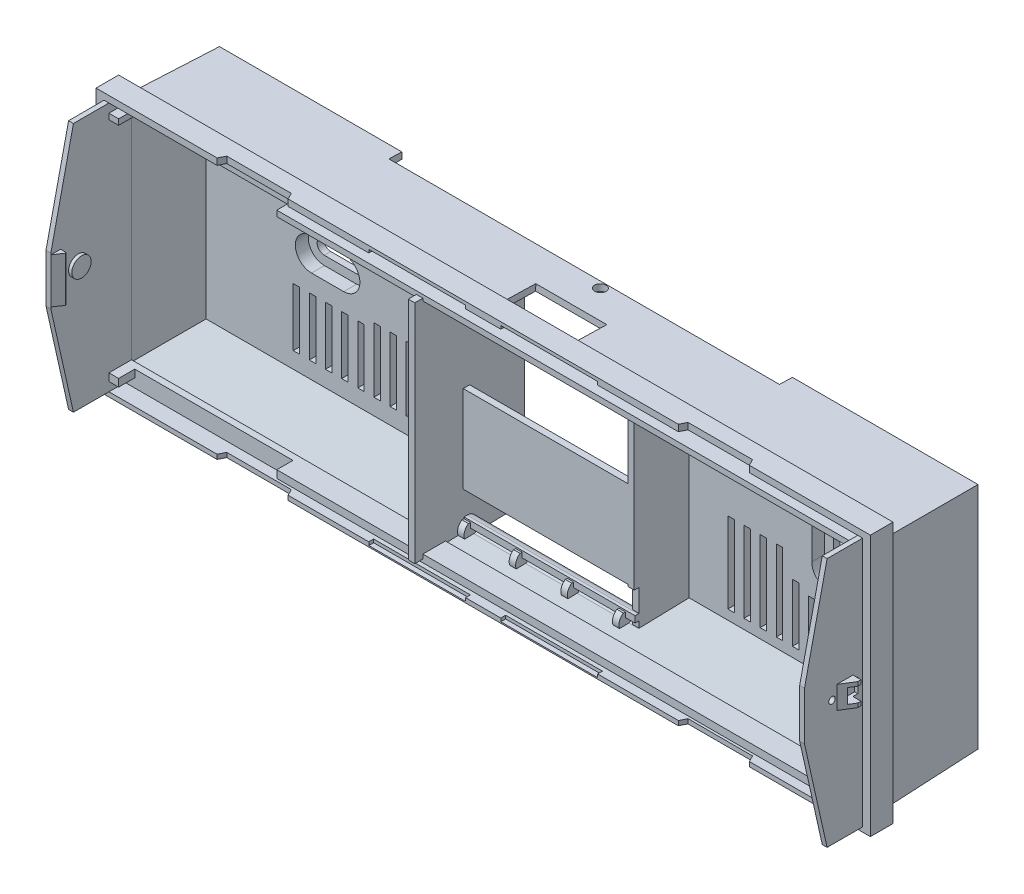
SolidWorks part; units mm, degrees
ref_plane "Plan1" through (0, 0, 0) normal (0, 0, 1) x (1, 0, 0)
ref_plane "Plan2" through (0, 0, 0) normal (0, 1, 0) x (1, 0, 0)
ref_plane "Plan3" through (0, 0, 0) normal (1, 0, 0) x (0, 0, -1)
sketch "Esquisse1" plane through (0, 0, 0) normal (0, 0, 1) x (1, 0, 0)
  line L1 (-124, 35.5) -> (111, 35.5)
  line L2 (-124, 35.5) -> (-124, -35.5)
  line L3 (-124, -35.5) -> (111, -35.5)
  line L4 (111, 35.5) -> (111, -35.5)
  dimension "D1" = 235
  dimension "D2" = 71
  dimension "D3" = 35.5
  dimension "D4" = 111
extrude "Extrusion1" add sketch "Esquisse1" along normal blind 1.5
sketch "Esquisse2" plane through (0, 0, 0) normal (0, 0, -1) x (-1, 0, 0)
  line L1 (-111, 35.5) -> (124, 35.5)
  line L2 (-111, 35.5) -> (-111, -35.5)
  line L3 (-111, -35.5) -> (124, -35.5)
  line L4 (124, 35.5) -> (124, -35.5)
extrude "Extrusion2" add sketch "Esquisse2" against normal blind 28.5 draft 1.5 from offset 4 contours L2 L3 L4 L1
sketch "Esquisse3" plane through (0, 0, 24.5) normal (0, 0, 1) x (1, 0, 0)
  line L0 (111.7463, 36.2463) -> (-124.7463, 36.2463) construction
  line L1 (-122.7463, 34.2463) -> (109.7463, 34.2463)
  line L2 (-122.7463, 34.2463) -> (-122.7463, -34.2463)
  line L3 (-122.7463, -34.2463) -> (109.7463, -34.2463)
  line L4 (109.7463, 34.2463) -> (109.7463, -34.2463)
  line L5 (-124.7463, 36.2463) -> (-124.7463, -36.2463) construction
  line L6 (111.7463, -36.2463) -> (-124.7463, -36.2463) construction
  line L7 (111.7463, 36.2463) -> (111.7463, -36.2463) construction
  dimension "D1" = 2
  dimension "D2" = 2
  dimension "D3" = 2
  dimension "D4" = 2
extrude "Enlèv. mat.-Extru.1" cut sketch "Esquisse3" against normal blind 22.5 draft 1.5
sketch "Esquisse4" plane through (0, 0, -4) normal (0, 0, -1) x (-1, 0, 0)
  line L0 (-111, 35.5) -> (124, 35.5) construction
  line L1 (-109, 33.5) -> (122, 33.5)
  line L2 (-109, 33.5) -> (-109, -33.5)
  line L3 (-109, -33.5) -> (122, -33.5)
  line L4 (122, 33.5) -> (122, -33.5)
  line L5 (-111, 35.5) -> (-111, -35.5) construction
  line L6 (-111, -35.5) -> (124, -35.5) construction
  line L7 (124, 35.5) -> (124, -35.5) construction
  dimension "D1" = 2
  dimension "D2" = 2
  dimension "D3" = 2
  dimension "D4" = 2
extrude "Enlèv. mat.-Extru.2" cut sketch "Esquisse4" against normal blind 4
sketch "Esquisse5" plane through (0, 0, 0) normal (0, 1, 0) x (1, 0, 0)
  line L1 (111, 4) -> (-124, 4) construction
  line L2 (-67.5, 4) -> (53.5, 4)
  line L3 (-67.5, 4) -> (-67.5, 0)
  line L4 (-67.5, 0) -> (53.5, 0)
  line L5 (53.5, 4) -> (53.5, 0)
  dimension "D1" = 4
  dimension "D2" = 121
  dimension "D3" = 67.5
extrude "Enlèv. mat.-Extru.3" cut sketch "Esquisse5" against normal mid plane 80
sketch "Esquisse6" plane through (0, 0, 0) normal (0, 0, -1) x (-1, 0, 0)
  line L0 (-111.7463, -36.2463) -> (124.7463, -36.2463) construction
  line L1 (-25.5, 33.6047) -> (25.5, 33.6047)
  line L2 (-25.5, 33.6047) -> (-25.5, -36.2463)
  line L3 (-25.5, -36.2463) -> (25.5, -36.2463)
  line L4 (25.5, 33.6047) -> (25.5, -36.2463)
  line L5 (-53.5, 35.6047) -> (67.5, 35.6047) construction
  dimension "D1" = 51
  dimension "D2" = 25.5
  dimension "D3" = 2
extrude "Enlèv. mat.-Extru.4" cut sketch "Esquisse6" against normal blind 17
sketch "Esquisse7" plane through (0, 35.5803, -0.9317) normal (0, 0.9997, -0.0262) x (-1, 0, 0)
  line L0 (-53.5, 0.932) -> (67.5, 0.932) construction
  line L2 (-11, 11.932) -> (11, 11.932)
  line L3 (-11, 11.932) -> (-11, 22.432)
  line L4 (-11, 22.432) -> (11, 22.432)
  line L5 (11, 11.932) -> (11, 22.432)
  circle A0 centre (0, 2.932) radius 1.75
  dimension "D1" = 3.5
  dimension "D2" = 2
  dimension "D3" = 10.5
  dimension "D4" = 22
  dimension "D5" = 11
  dimension "D6" = 11
extrude "Enlèv. mat.-Extru.5" cut sketch "Esquisse7" against normal blind 10
sketch "Esquisse8" plane through (0, 0, 0) normal (0, 0, -1) x (-1, 0, 0)
  line L0 (-25.5, 33.6047) -> (-25.5, -35.6047) construction
  line L1 (-111, 35.5) -> (-53.5, 35.5) construction
  line L2 (-78.5, 5) -> (-78.5, -5)
  line L3 (67.5, 35.5) -> (124, 35.5) construction
  line L4 (-62.5, 5) -> (-62.5, -5)
  line L5 (79.5, 8) -> (89.5, 8)
  line L6 (25.5, -35.6047) -> (25.5, 33.6047) construction
  line L7 (79.5, -8) -> (89.5, -8)
  arc A0 (-78.5, 5) -> (-62.5, 5) centre (-70.5, 5) cw
  arc A1 (-62.5, -5) -> (-78.5, -5) centre (-70.5, -5) cw
  arc A2 (79.5, 8) -> (79.5, -8) centre (79.5, 0) ccw
  arc A3 (89.5, 8) -> (89.5, -8) centre (89.5, 0) cw
  dimension "D7" = 8
  dimension "D8" = 8
  dimension "D1" = 16
  dimension "D2" = 10
  dimension "D3" = 10
  dimension "D4" = 10
  dimension "D5" = 53
  dimension "D6" = 30.5
  dimension "D9" = 10
  dimension "D10" = 10
  dimension "D11" = 10
  dimension "D12" = 16
  dimension "D13" = 35.5
  dimension "D14" = 64
extrude "Extrusion3" add sketch "Esquisse8" along normal blind 4
sketch "Esquisse9" plane through (81.6987, 0.3521, -4) normal (0, 0, -1) x (-1, 0, 0)
  line L2 (161.1987, 4.6479) -> (171.1987, 4.6479)
  line L4 (161.1987, -5.3521) -> (171.1987, -5.3521)
  line L8 (6.1987, 4.6479) -> (6.1987, -5.3521)
  line L9 (16.1987, 4.6479) -> (16.1987, -5.3521)
  arc A0 (19.1987, 4.6479) -> (3.1987, 4.6479) centre (11.1987, 4.6479) ccw construction
  arc A1 (3.1987, -5.3521) -> (19.1987, -5.3521) centre (11.1987, -5.3521) ccw construction
  arc A2 (171.1987, -8.3521) -> (171.1987, 7.6479) centre (171.1987, -0.3521) ccw construction
  arc A3 (161.1987, 7.6479) -> (161.1987, -8.3521) centre (161.1987, -0.3521) ccw construction
  arc A6 (16.1987, -5.3521) -> (6.1987, -5.3521) centre (11.1987, -5.3521) cw
  arc A7 (6.1987, 4.6479) -> (16.1987, 4.6479) centre (11.1987, 4.6479) cw
  arc A8 (171.1987, 4.6479) -> (171.1987, -5.3521) centre (171.1987, -0.3521) cw
  arc A9 (161.1987, 4.6479) -> (161.1987, -5.3521) centre (161.1987, -0.3521) ccw
  dimension "D7" = 10
  dimension "D8" = 5
  dimension "D2" = 5
  dimension "D5" = 5
  dimension "D1" = 5
  dimension "D3" = 10
  dimension "D4" = 10
  dimension "D6" = 10
  dimension "D9" = 10
  dimension "D10" = 10
extrude "Enlèv. mat.-Extru.6" cut sketch "Esquisse9" against normal blind 10 from offset 2
sketch "Esquisse10" plane through (0, 0, -4) normal (0, 0, -1) x (-1, 0, 0)
  line L2 (-72.75, 5) -> (-72.75, -5)
  line L3 (79.5, 2.25) -> (89.5, 2.25)
  line L4 (-68.25, 5) -> (-68.25, -5)
  line L6 (79.5, -2.25) -> (89.5, -2.25)
  arc A0 (-72.75, 5) -> (-68.25, 5) centre (-70.5, 5) cw
  arc A1 (-68.25, -5) -> (-72.75, -5) centre (-70.5, -5) cw
  arc A2 (-62.5, 5) -> (-78.5, 5) centre (-70.5, 5) ccw construction
  arc A3 (-78.5, -5) -> (-62.5, -5) centre (-70.5, -5) ccw construction
  arc A4 (79.5, 2.25) -> (79.5, -2.25) centre (79.5, 0) ccw
  arc A5 (89.5, 2.25) -> (89.5, -2.25) centre (89.5, 0) cw
  arc A6 (89.5, -8) -> (89.5, 8) centre (89.5, 0) ccw construction
  arc A7 (79.5, 8) -> (79.5, -8) centre (79.5, 0) ccw construction
  dimension "D2" = 2.25
  dimension "D3" = 4.5
  dimension "D5" = 10
  dimension "D1" = 4.5
  dimension "D4" = 10
  dimension "D6" = 10
extrude "Enlèv. mat.-Extru.7" cut sketch "Esquisse10" against normal blind 10
sketch "Esquisse11" plane through (0, 0, 2) normal (0, 0, 1) x (1, 0, 0)
  line L1 (25.5, 35) -> (27.5, 35)
  line L2 (25.5, 35) -> (25.5, -35)
  line L3 (25.5, -35) -> (27.5, -35)
  line L4 (27.5, 35) -> (27.5, -35)
  dimension "D1" = 2
  dimension "D2" = 70
  dimension "D3" = 35
  dimension "D4" = 25.5
extrude "Extrusion4" add sketch "Esquisse11" along normal blind 17
sketch "Esquisse12" plane through (0, 0, 2) normal (0, 0, 1) x (1, 0, 0)
  line L1 (-25.5, 35) -> (-27.5, 35)
  line L2 (-25.5, 35) -> (-25.5, -35)
  line L3 (-25.5, -35) -> (-27.5, -35)
  line L4 (-27.5, 35) -> (-27.5, -35)
  dimension "D1" = 2
  dimension "D2" = 70
  dimension "D3" = 35
  dimension "D4" = 25.5
extrude "Extrusion5" add sketch "Esquisse12" along normal blind 32
sketch "Esquisse13" plane through (25.5, 0, 0) normal (-1, 0, 0) x (0, 0, 1)
  line L1 (19, 4.5) -> (17, 4.5)
  line L2 (19, 4.5) -> (19, -22.5)
  line L3 (19, -22.5) -> (17, -22.5)
  line L4 (17, 4.5) -> (17, -22.5)
  line L6 (0, 0) -> (23.4559, 0) construction
  line L7 (19, 34.1023) -> (19, -34.1023) construction
  dimension "D1" = 2
  dimension "D2" = 27
  dimension "D3" = 4.5
extrude "Extrusion6" add sketch "Esquisse13" along normal up to next
sketch "Esquisse15" plane through (27.5, 0, 0) normal (1, 0, 0) x (0, 0, -1)
  line L0 (-19, -34.1023) -> (-19, 34.1023) construction
  line L1 (-17.5, -34.063) -> (-19, -34.1023)
  line L2 (-19, -34.1023) -> (-19, -23.1023)
  line L3 (-19, -23.1023) -> (-17.5, -23.1023)
  line L4 (-17.5, -34.063) -> (-17.5, -23.1023)
  line L7 (-19, -34.1023) -> (-2, -33.6571) construction
  point P11 (-13.9712, -36.3603)
  dimension "D1" = 11
  dimension "D2" = 1.5
extrude "Enlèv. mat.-Extru.8" cut sketch "Esquisse15" against normal blind 10
sketch "Esquisse14" plane through (-25.5, 0, 0) normal (1, 0, 0) x (0, 0, -1)
  line L0 (-24.5, -36.2463) -> (4, -35.5) construction
  line L1 (0, -35.6047) -> (0, 33.6047) construction
  line L2 (-17.75, -34.0695) -> (-17.75, -36.0695)
  line L3 (-17.75, -32.0695) -> (-18.75, -32.0695)
  line L4 (-18.75, -32.0695) -> (-18.75, -30.0695)
  line L5 (-18.75, -30.0695) -> (-17.75, -30.0695)
  arc A0 (-17.75, -36.0695) -> (-17.75, -30.0695) centre (-17.75, -33.0695) ccw
  arc A1 (-17.75, -34.0695) -> (-17.75, -32.0695) centre (-17.75, -33.0695) ccw
  dimension "D1" = 3
  dimension "D2" = 17.75
  dimension "D4" = 1
  dimension "D3" = 2
extrude "Extrusion7" add sketch "Esquisse14" along normal up to surface (53 mm away)
sketch "Esquisse16" plane through (-25.5, 0, 0) normal (1, 0, 0) x (0, 0, -1)
  line L0 (-20.3644, -34.5409) -> (-16.3644, -34.5409)
  line L1 (-16.3644, -34.5409) -> (-16.3644, -30.5409)
  line L2 (-16.3644, -30.5409) -> (-19.3644, -30.5409)
  arc A0 (-17.6977, -34.0682) -> (-17.75, -32.0695) centre (-17.75, -33.0695) ccw construction
  arc A2 (-19.3644, -30.5409) -> (-20.3644, -34.5409) centre (-17.75, -33.0695) ccw
  point P1 (-18.6119, -29.1773)
  point P7 (-19.9491, -35.2924)
  dimension "D1" = 3
  dimension "D2" = 4
  dimension "D3" = 4
  dimension "D4" = 1
extrude "Extrusion8" add sketch "Esquisse16" along normal blind 2
pattern_linear "Répétition linéaire1" count 4 spacing 16 along (1, 0, 0) of "Extrusion8"
sketch "Esquisse17" plane through (0, 0, 24.5) normal (0, 0, 1) x (1, 0, 0)
  line L1 (-122.7463, 34.2463) -> (109.1571, 34.2463)
  line L2 (-122.7463, 34.2463) -> (-122.7463, -33.6571)
  line L3 (-122.7463, -33.6571) -> (109.1571, -33.6571)
  line L4 (109.1571, 34.2463) -> (109.1571, -33.6571)
  line L5 (-126.7463, 40.7463) -> (113.1571, 40.7463)
  line L6 (-126.7463, 40.7463) -> (-126.7463, -40.1571)
  line L7 (-126.7463, -40.1571) -> (113.1571, -40.1571)
  line L8 (113.1571, 40.7463) -> (113.1571, -40.1571)
  dimension "D1" = 6.5
  dimension "D2" = 6.5
  dimension "D3" = 4
  dimension "D4" = 4
extrude "Extrusion9" add sketch "Esquisse17" along normal blind 7
sketch "Esquisse18" plane through (0, 0, 31.5) normal (0, 0, 1) x (1, 0, 0)
  line L0 (-122.7463, 34.2463) -> (-122.7463, -33.6571) construction
  line L1 (-122.7463, 35.9963) -> (109.1571, 35.9963)
  line L2 (-122.7463, 35.9963) -> (-122.7463, 38.7463)
  line L3 (-122.7463, 38.7463) -> (109.1571, 38.7463)
  line L4 (109.1571, 35.9963) -> (109.1571, 38.7463)
  line L5 (109.1571, -33.6571) -> (109.1571, 34.2463) construction
  line L6 (113.1571, 40.7463) -> (-126.7463, 40.7463) construction
  line L7 (0, 0) -> (-126.1043, 0) construction
  line L8 (109.1571, -35.9963) -> (109.1571, -38.7463)
  line L9 (-122.7463, -38.7463) -> (109.1571, -38.7463)
  line L10 (-122.7463, -35.9963) -> (-122.7463, -38.7463)
  line L11 (-122.7463, -35.9963) -> (109.1571, -35.9963)
  dimension "D1" = 2.75
  dimension "D2" = 2
extrude "Enlèv. mat.-Extru.9" cut sketch "Esquisse18" against normal blind 5
sketch "Esquisse19" plane through (0, -40.1571, 0) normal (0, -1, 0) x (1, 0, 0)
  line L0 (-126.7463, 31.5) -> (113.1571, 31.5) construction
  line L1 (-67.2463, 31.5) -> (-89.2463, 31.5)
  line L2 (-68.2463, 29.5) -> (-67.2463, 31.5)
  line L3 (-68.2463, 29.5) -> (-88.2463, 29.5)
  line L4 (-88.2463, 29.5) -> (-89.2463, 31.5)
  line L5 (113.1571, 31.5) -> (113.1571, 24.5) construction
  line L6 (74.6571, 29.5) -> (75.6571, 31.5)
  line L7 (54.6571, 29.5) -> (74.6571, 29.5)
  line L8 (54.6571, 29.5) -> (53.6571, 31.5)
  line L9 (53.6571, 31.5) -> (75.6571, 31.5)
  line L10 (-126.7463, 31.5) -> (-126.7463, 24.5) construction
  point P6 (113.1571, 28)
  point P13 (-126.7463, 28)
  dimension "D1" = 2
  dimension "D2" = 20
  dimension "D3" = 22
  dimension "D4" = 1
  dimension "D5" = 38.5
  dimension "D6" = 22
  dimension "D7" = 20
  dimension "D9" = 1
  dimension "D10" = 2
  dimension "D11" = 38.5
extrude "Enlèv. mat.-Extru.10" cut sketch "Esquisse19" against normal blind 2.5 and the other way blind 1
sketch "Esquisse20" plane through (0, 0, 31.5) normal (0, 0, 1) x (1, 0, 0)
  line L0 (-67.2463, -38.7463) -> (53.6571, -38.7463) construction
  line L1 (-42.2463, -38.7463) -> (-12.2463, -38.7463)
  line L2 (-42.2463, -38.7463) -> (-42.2463, -39.7463)
  line L3 (-42.2463, -39.7463) -> (-12.2463, -39.7463)
  line L4 (-12.2463, -38.7463) -> (-12.2463, -39.7463)
  line L5 (-67.2463, -38.7463) -> (-67.2463, -40.1571) construction
  line L6 (28.6571, -38.7463) -> (-1.3429, -38.7463)
  line L7 (28.6571, -38.7463) -> (28.6571, -39.7463)
  line L8 (28.6571, -39.7463) -> (-1.3429, -39.7463)
  line L9 (-1.3429, -38.7463) -> (-1.3429, -39.7463)
  point P10 (-67.2463, -39.4517)
  dimension "D1" = 1
  dimension "D2" = 30
  dimension "D3" = 25
  dimension "D4" = 1
  dimension "D5" = 30
  dimension "D6" = 25
extrude "Enlèv. mat.-Extru.11" cut sketch "Esquisse20" against normal blind 1.5
mirror "Symétrie1" about plane through (0, 0, 0) normal (0, 1, 0) of "Enlèv. mat.-Extru.10", "Enlèv. mat.-Extru.11"
sketch "Esquisse22" plane through (-122.7463, 0, 0) normal (1, 0, 0) x (0, 0, -1)
  line L0 (-31.5, -38.7463) -> (-42.5, -38.7463)
  line L1 (-42.5, -38.7463) -> (-49.5, -7.5013)
  line L2 (-49.5, -7.5013) -> (-49.5, 7.4987)
  line L3 (-49.5, 7.4987) -> (-42.5, 38.7463)
  line L4 (-42.5, 38.7463) -> (-31.5, 38.7463)
  line L6 (-31.5, 38.7463) -> (-31.5, -38.7463)
  line L10 (-26.5, -38.7463) -> (-31.5, -38.7463) construction
  line L11 (-26.5, 38.7463) -> (-31.5, 38.7463) construction
  dimension "D1" = 11
  dimension "D2" = 11
  dimension "D3" = 7
  dimension "D4" = 15
  dimension "D5" = 31.245
extrude "Extrusion11" add sketch "Esquisse22" against normal blind 1.5
sketch "Esquisse23" plane through (0, 0, 0) normal (0, 1, 0) x (1, 0, 0)
  line L0 (-122.7463, -49.5) -> (-120.7463, -46.5)
  line L1 (-120.7463, -46.5) -> (-122.7463, -46.5)
  line L2 (-122.7463, -42.5) -> (-122.7463, -49.5) construction
  line L3 (-122.7463, -46.5) -> (-122.7463, -49.5)
  dimension "D1" = 2
  dimension "D2" = 3
extrude "Extrusion12" add sketch "Esquisse23" along normal mid plane 14
sketch "Esquisse24" plane through (0, 0, 0) normal (0, 1, 0) x (1, 0, 0)
  line L0 (-124.2463, -39.5) -> (-126.7463, -35.5)
  line L1 (-124.2463, -42.5) -> (-124.2463, -31.5) construction
  line L2 (-126.7463, -35.5) -> (-126.7463, -34.5)
  line L3 (-126.7463, -34.5) -> (-124.2463, -34.5)
  line L4 (-124.2463, -34.5) -> (-124.2463, -39.5)
  line L5 (-126.7463, -31.5) -> (-89.2463, -31.5) construction
  dimension "D1" = 2.5
  dimension "D2" = 1
  dimension "D3" = 4
  dimension "D4" = 3
extrude "Extrusion13" add sketch "Esquisse24" along normal mid plane 7
fillet "Congé1" radius 0.2 1 edges at (-120.7463, 0, 46.5)
sketch "Esquisse25" plane through (0, 0, 0) normal (0, 1, 0) x (1, 0, 0)
  line L0 (-125.4963, -37.5) -> (-123.2463, -36.0938)
  line L1 (-126.7463, -35.5) -> (-124.2463, -39.5) construction
  line L2 (-123.2463, -36.0938) -> (-123.2463, -33)
  line L3 (-123.2463, -33) -> (-127.2463, -33)
  line L4 (-127.2463, -33) -> (-127.2463, -37.5)
  line L5 (-127.2463, -37.5) -> (-125.4963, -37.5)
  line L6 (-124.2463, -34.5) -> (-126.7463, -34.5) construction
  line L7 (-124.2463, -31.5) -> (-124.2463, -42.5) construction
  line L8 (-126.7463, -35.5) -> (-124.2463, -39.5) construction
  dimension "D1" = 1.5
  dimension "D2" = 1
  dimension "D3" = 90
  dimension "D4" = 4
extrude "Enlèv. mat.-Extru.12" cut sketch "Esquisse25" against normal mid plane 4.5
sketch "Esquisse26" plane through (-124.2463, 0, 0) normal (-1, 0, 0) x (0, 0, 1)
  line L0 (50, 0) -> (-50, 0) construction
  line L1 (49.5, 7.4987) -> (49.5, -7.5013) construction
  circle A0 centre (41, 0) radius 1
  point P6 (49.5, -0.0013)
  dimension "D1" = 2
  dimension "D2" = 8.5
extrude "Enlèv. mat.-Extru.13" cut sketch "Esquisse26" against normal blind 2
sketch "Esquisse27" plane through (-122.7463, 0, 0) normal (1, 0, 0) x (0, 0, -1)
  circle A0 centre (-41, 0) radius 3
  dimension "D1" = 6
extrude "Extrusion14" add sketch "Esquisse27" along normal blind 1
ref_plane "Plan4" through (-6.7463, 0, 0) normal (-1, 0, 0) x (0, 0, 1)
mirror "Symétrie3" about plane through (-6.7463, 0, 0) normal (-1, 0, 0) of "Extrusion14", "Enlèv. mat.-Extru.13", "Enlèv. mat.-Extru.12", "Congé1", "Extrusion13", "Extrusion12", "Extrusion11"
sketch "Esquisse28" plane through (0, 0, 2) normal (0, 0, 1) x (1, 0, 0)
  line L0 (-122.1571, 33.6571) -> (-122.1571, -33.6571) construction
  line L1 (-95.1571, 28.6571) -> (-93.1571, 28.6571)
  line L2 (-95.1571, 28.6571) -> (-95.1571, 8.6571)
  line L3 (-95.1571, 8.6571) -> (-93.1571, 8.6571)
  line L4 (-93.1571, 28.6571) -> (-93.1571, 8.6571)
  line L5 (-27.5, 33.6571) -> (-122.1571, 33.6571) construction
  line L6 (-90.1571, 28.6571) -> (-88.1571, 28.6571)
  line L7 (-90.1571, 28.6571) -> (-90.1571, 8.6571)
  line L8 (-90.1571, 8.6571) -> (-88.1571, 8.6571)
  line L9 (-88.1571, 28.6571) -> (-88.1571, 8.6571)
  line L10 (-85.1571, 28.6571) -> (-83.1571, 28.6571)
  line L11 (-85.1571, 28.6571) -> (-85.1571, 8.6571)
  line L12 (-85.1571, 8.6571) -> (-83.1571, 8.6571)
  line L13 (-83.1571, 28.6571) -> (-83.1571, 8.6571)
  line L14 (-80.1571, 28.6571) -> (-78.1571, 28.6571)
  line L15 (-80.1571, 28.6571) -> (-80.1571, 8.6571)
  line L16 (-80.1571, 8.6571) -> (-78.1571, 8.6571)
  line L17 (-78.1571, 28.6571) -> (-78.1571, 8.6571)
  line L18 (-75.1571, 28.6571) -> (-73.1571, 28.6571)
  line L19 (-75.1571, 28.6571) -> (-75.1571, 8.6571)
  line L20 (-75.1571, 8.6571) -> (-73.1571, 8.6571)
  line L21 (-73.1571, 28.6571) -> (-73.1571, 8.6571)
  line L22 (-70.1571, 28.6571) -> (-68.1571, 28.6571)
  line L23 (-70.1571, 28.6571) -> (-70.1571, 8.6571)
  line L24 (-70.1571, 8.6571) -> (-68.1571, 8.6571)
  line L25 (-68.1571, 28.6571) -> (-68.1571, 8.6571)
  line L26 (-65.1571, 28.6571) -> (-63.1571, 28.6571)
  line L27 (-65.1571, 28.6571) -> (-65.1571, 8.6571)
  line L28 (-65.1571, 8.6571) -> (-63.1571, 8.6571)
  line L29 (-63.1571, 28.6571) -> (-63.1571, 8.6571)
  line L30 (-60.1571, 28.6571) -> (-58.1571, 28.6571)
  line L31 (-60.1571, 28.6571) -> (-60.1571, 8.6571)
  line L32 (-60.1571, 8.6571) -> (-58.1571, 8.6571)
  line L33 (-58.1571, 28.6571) -> (-58.1571, 8.6571)
  line L34 (-55.1571, 28.6571) -> (-53.1571, 28.6571)
  line L35 (-55.1571, 28.6571) -> (-55.1571, 8.6571)
  line L36 (-55.1571, 8.6571) -> (-53.1571, 8.6571)
  line L37 (-53.1571, 28.6571) -> (-53.1571, 8.6571)
  line L38 (-89.5, 0) -> (-79.5, 0) construction
  line L39 (-53.1571, -28.6571) -> (-53.1571, -8.6571)
  line L40 (-55.1571, -8.6571) -> (-53.1571, -8.6571)
  line L41 (-55.1571, -28.6571) -> (-55.1571, -8.6571)
  line L42 (-55.1571, -28.6571) -> (-53.1571, -28.6571)
  line L43 (-58.1571, -28.6571) -> (-58.1571, -8.6571)
  line L44 (-60.1571, -8.6571) -> (-58.1571, -8.6571)
  line L45 (-60.1571, -28.6571) -> (-60.1571, -8.6571)
  line L46 (-60.1571, -28.6571) -> (-58.1571, -28.6571)
  line L47 (-63.1571, -28.6571) -> (-63.1571, -8.6571)
  line L48 (-65.1571, -8.6571) -> (-63.1571, -8.6571)
  line L49 (-65.1571, -28.6571) -> (-65.1571, -8.6571)
  line L50 (-65.1571, -28.6571) -> (-63.1571, -28.6571)
  line L51 (-68.1571, -28.6571) -> (-68.1571, -8.6571)
  line L52 (-70.1571, -8.6571) -> (-68.1571, -8.6571)
  line L53 (-70.1571, -28.6571) -> (-70.1571, -8.6571)
  line L54 (-70.1571, -28.6571) -> (-68.1571, -28.6571)
  line L55 (-90.1571, -10.6571) -> (-88.1571, -10.6571)
  line L56 (-95.1571, -10.6571) -> (-93.1571, -10.6571)
  line L57 (-95.1571, -10.6571) -> (-95.1571, -28.6571)
  line L58 (-95.1571, -28.6571) -> (-93.1571, -28.6571)
  line L59 (-93.1571, -10.6571) -> (-93.1571, -28.6571)
  line L60 (-90.1571, -10.6571) -> (-90.1571, -28.6571)
  line L61 (-90.1571, -28.6571) -> (-88.1571, -28.6571)
  line L62 (-88.1571, -10.6571) -> (-88.1571, -28.6571)
  line L63 (-85.1571, -10.6571) -> (-83.1571, -10.6571)
  line L64 (-85.1571, -10.6571) -> (-85.1571, -28.6571)
  line L65 (-85.1571, -28.6571) -> (-83.1571, -28.6571)
  line L66 (-83.1571, -10.6571) -> (-83.1571, -28.6571)
  line L67 (-80.1571, -10.6571) -> (-78.1571, -10.6571)
  line L68 (-80.1571, -10.6571) -> (-80.1571, -28.6571)
  line L69 (-80.1571, -28.6571) -> (-78.1571, -28.6571)
  line L70 (-78.1571, -10.6571) -> (-78.1571, -28.6571)
  line L71 (-75.1571, -10.6571) -> (-73.1571, -10.6571)
  line L72 (-75.1571, -10.6571) -> (-75.1571, -28.6571)
  line L73 (-75.1571, -28.6571) -> (-73.1571, -28.6571)
  line L74 (-73.1571, -10.6571) -> (-73.1571, -28.6571)
  line L75 (-122.7463, -33.6571) -> (-27.5, -33.6571) construction
  line L76 (-25.5, -33.6571) -> (109.1571, -33.6571) construction
  line L77 (39.5, -30.6571) -> (41.5, -30.6571)
  line L78 (39.5, -30.6571) -> (39.5, -5.6571)
  line L79 (39.5, -5.6571) -> (41.5, -5.6571)
  line L80 (41.5, -30.6571) -> (41.5, -5.6571)
  line L81 (27.5, -23.1023) -> (27.5, 34.1023) construction
  line L82 (44.5, -30.6571) -> (46.5, -30.6571)
  line L83 (44.5, -30.6571) -> (44.5, -5.6571)
  line L84 (44.5, -5.6571) -> (46.5, -5.6571)
  line L85 (46.5, -30.6571) -> (46.5, -5.6571)
  line L86 (49.5, -30.6571) -> (51.5, -30.6571)
  line L87 (49.5, -30.6571) -> (49.5, -5.6571)
  line L88 (49.5, -5.6571) -> (51.5, -5.6571)
  line L89 (51.5, -30.6571) -> (51.5, -5.6571)
  line L90 (54.5, -30.6571) -> (56.5, -30.6571)
  line L91 (54.5, -30.6571) -> (54.5, -5.6571)
  line L92 (54.5, -5.6571) -> (56.5, -5.6571)
  line L93 (56.5, -30.6571) -> (56.5, -5.6571)
  line L94 (-25.5, -33.6571) -> (109.1571, -33.6571) construction
  line L95 (109.1571, 33.6571) -> (27.5, 33.6571) construction
  line L96 (59.5, -30.6571) -> (61.5, -30.6571)
  line L97 (59.5, -30.6571) -> (59.5, -12.6571)
  line L98 (59.5, -12.6571) -> (61.5, -12.6571)
  line L99 (61.5, -30.6571) -> (61.5, -12.6571)
  line L100 (64.5, -30.6571) -> (66.5, -30.6571)
  line L101 (64.5, -30.6571) -> (64.5, -14.6571)
  line L102 (64.5, -14.6571) -> (66.5, -14.6571)
  line L103 (66.5, -30.6571) -> (66.5, -14.6571)
  line L104 (69.5, -30.6571) -> (71.5, -30.6571)
  line L105 (69.5, -30.6571) -> (69.5, -14.6571)
  line L106 (69.5, -14.6571) -> (71.5, -14.6571)
  line L107 (71.5, -30.6571) -> (71.5, -14.6571)
  line L108 (74.5, -30.6571) -> (76.5, -30.6571)
  line L109 (74.5, -30.6571) -> (74.5, -12.6571)
  line L110 (74.5, -12.6571) -> (76.5, -12.6571)
  line L111 (76.5, -30.6571) -> (76.5, -12.6571)
  line L112 (79.5, -30.6571) -> (81.5, -30.6571)
  line L113 (79.5, -30.6571) -> (79.5, -5.6571)
  line L114 (79.5, -5.6571) -> (81.5, -5.6571)
  line L115 (81.5, -30.6571) -> (81.5, -5.6571)
  line L116 (81.5, 5.6571) -> (79.5, 5.6571)
  line L117 (81.5, 5.6571) -> (81.5, 28.6571)
  line L118 (81.5, 28.6571) -> (79.5, 28.6571)
  line L119 (79.5, 5.6571) -> (79.5, 28.6571)
  line L120 (109.2537, 38.7463) -> (109.2537, 7.4987) construction
  line L121 (71.5, 28.6571) -> (69.5, 28.6571)
  line L122 (76.5, 28.6571) -> (74.5, 28.6571)
  line L123 (76.5, 28.6571) -> (76.5, 13.6571)
  line L124 (76.5, 13.6571) -> (74.5, 13.6571)
  line L125 (74.5, 28.6571) -> (74.5, 13.6571)
  line L126 (71.5, 28.6571) -> (71.5, 13.6571)
  line L127 (71.5, 13.6571) -> (69.5, 13.6571)
  line L128 (69.5, 28.6571) -> (69.5, 13.6571)
  line L129 (66.5, 28.6571) -> (64.5, 28.6571)
  line L130 (66.5, 28.6571) -> (66.5, 13.6571)
  line L131 (66.5, 13.6571) -> (64.5, 13.6571)
  line L132 (64.5, 28.6571) -> (64.5, 13.6571)
  line L133 (61.5, 28.6571) -> (59.5, 28.6571)
  line L134 (61.5, 28.6571) -> (61.5, 13.6571)
  line L135 (61.5, 13.6571) -> (59.5, 13.6571)
  line L136 (59.5, 28.6571) -> (59.5, 13.6571)
  line L137 (51.5, 28.6571) -> (49.5, 28.6571)
  line L138 (56.5, 28.6571) -> (54.5, 28.6571)
  line L139 (56.5, 28.6571) -> (56.5, 5.6571)
  line L140 (56.5, 5.6571) -> (54.5, 5.6571)
  line L141 (54.5, 28.6571) -> (54.5, 5.6571)
  line L142 (51.5, 28.6571) -> (51.5, 5.6571)
  line L143 (51.5, 5.6571) -> (49.5, 5.6571)
  line L144 (49.5, 28.6571) -> (49.5, 5.6571)
  line L145 (46.5, 28.6571) -> (44.5, 28.6571)
  line L146 (46.5, 28.6571) -> (46.5, 5.6571)
  line L147 (46.5, 5.6571) -> (44.5, 5.6571)
  line L148 (44.5, 28.6571) -> (44.5, 5.6571)
  line L149 (41.5, 28.6571) -> (39.5, 28.6571)
  line L150 (41.5, 28.6571) -> (41.5, 5.6571)
  line L151 (41.5, 5.6571) -> (39.5, 5.6571)
  line L152 (39.5, 28.6571) -> (39.5, 5.6571)
  point P86 (41.8286, -33.6571)
  dimension "D1" = 27
  dimension "D2" = 2
  dimension "D3" = 20
  dimension "D4" = 5
  dimension "D5" = 5
  dimension "D6" = 5
  dimension "D7" = 27
  dimension "D8" = 2
  dimension "D9" = 18
  dimension "D10" = 5
  dimension "D11" = 5
  dimension "D12" = 3
  dimension "D13" = 25
  dimension "D14" = 2
  dimension "D15" = 12
  dimension "D16" = 5
  dimension "D17" = 3
  dimension "D18" = 2
  dimension "D19" = 3
  dimension "D20" = 3
  dimension "D21" = 2
  dimension "D22" = 3
  dimension "D23" = 2
  dimension "D24" = 3
  dimension "D25" = 2
  dimension "D26" = 3
  dimension "D27" = 2
  dimension "D28" = 25
  dimension "D29" = 18
  dimension "D30" = 16
  dimension "D31" = 16
  dimension "D32" = 18
  dimension "D33" = 5
  dimension "D34" = 23
  dimension "D35" = 2
  dimension "D36" = 27.7537
  dimension "D37" = 3
  dimension "D38" = 2
  dimension "D39" = 15
  dimension "D40" = 5
  dimension "D41" = 5
  dimension "D42" = 2
  dimension "D43" = 23
  dimension "D44" = 5
extrude "Enlèv. mat.-Extru.14" cut sketch "Esquisse28" against normal blind 10
sketch "Esquisse29" plane through (0, 0, 0) normal (0, 1, 0) x (1, 0, 0)
  line L0 (-126.7463, -31.5) -> (-89.2463, -31.5) construction
  line L1 (-119.7463, -31.5) -> (-70.7463, -31.5)
  line L2 (-119.7463, -31.5) -> (-119.7463, -26.5)
  line L3 (-119.7463, -26.5) -> (-70.7463, -26.5)
  line L4 (-70.7463, -31.5) -> (-70.7463, -26.5)
  line L5 (-122.7463, -42.5) -> (-122.7463, -31.5) construction
  dimension "D1" = 49
  dimension "D2" = 3
  dimension "D3" = 5
extrude "Enlèv. mat.-Extru.15" cut sketch "Esquisse29" against normal blind 38 and the other way blind 38
